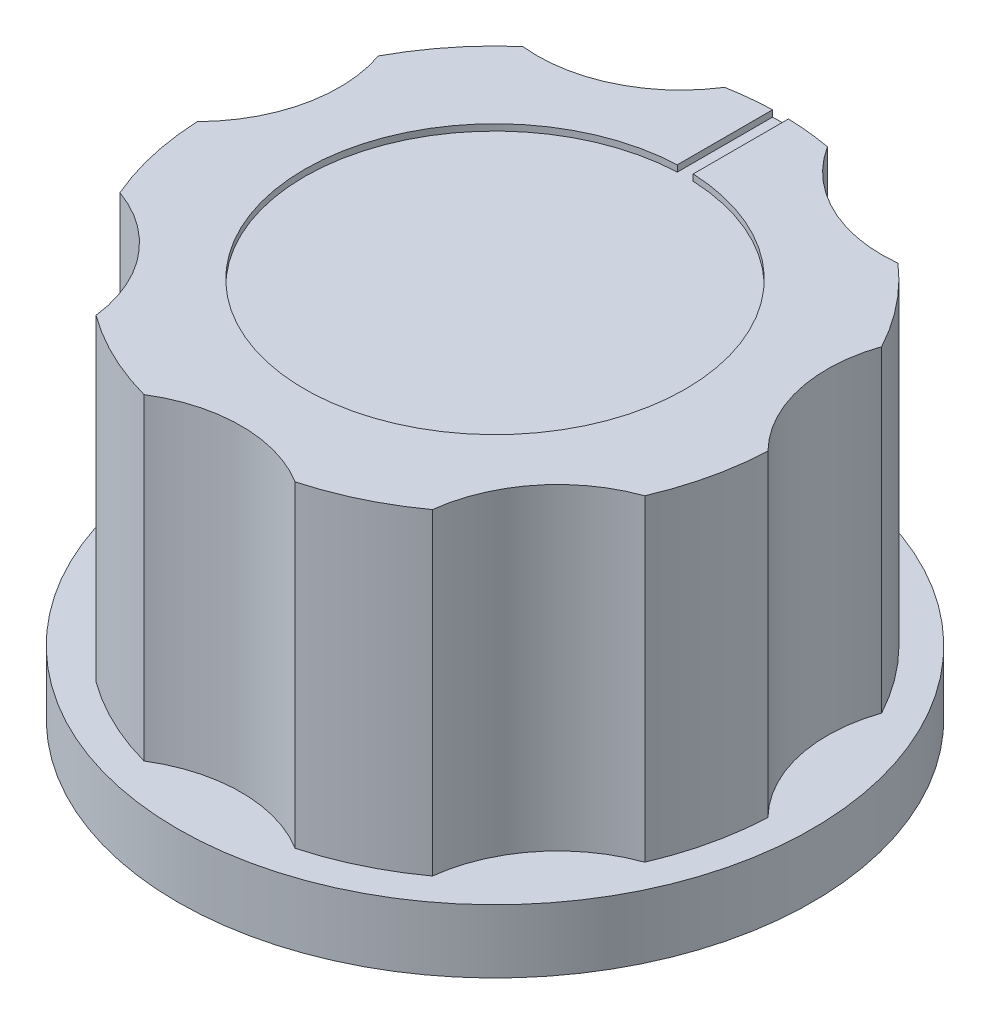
SolidWorks part; units mm, degrees
ref_plane "Alzado" through (0, 0, 0) normal (0, 0, 1) x (1, 0, 0)
ref_plane "Planta" through (0, 0, 0) normal (0, 1, 0) x (1, 0, 0)
ref_plane "Vista lateral" through (0, 0, 0) normal (1, 0, 0) x (0, 0, -1)
sketch "Croquis1" plane through (0, 0, 0) normal (0, 0, 1) x (1, 0, 0)
  line L0 (10, 2) -> (0, 2)
  line L1 (0, 2) -> (0, 0)
  line L2 (0, 0) -> (10, 0)
  line L3 (10, 0) -> (10, 2)
  line L4 (0, 2) -> (0, 0) construction
revolve "Revolución1" add sketch "Croquis1" angle 360 about L4
sketch "Croquis2" plane through (0, 2, 0) normal (0, 1, 0) x (-1, 0, 0)
  arc A0 (-1.6222, -8.8526) -> (-5.9119, -6.786) centre (-5.4313, -11.2739) ccw
  arc A1 (-5.9119, -6.786) -> (-7.9327, -4.2511) centre (0, 0) cw
  arc A2 (-7.9327, -4.2511) -> (-8.9915, 0.39) centre (-12.201, -2.7835) ccw
  arc A3 (-8.9915, 0.39) -> (-8.2699, 3.5508) centre (0, 0) cw
  arc A4 (-8.2699, 3.5508) -> (-5.3016, 7.2728) centre (-9.7838, 7.8028) ccw
  arc A5 (-5.3016, 7.2728) -> (-2.3813, 8.6793) centre (0, 0) cw
  arc A6 (-2.3813, 8.6793) -> (2.3812, 8.6793) centre (0, 12.5135) ccw
  arc A7 (2.3812, 8.6793) -> (5.3005, 7.2735) centre (0, 0) cw
  arc A8 (5.3005, 7.2735) -> (8.2709, 3.5486) centre (9.7831, 7.8013) ccw
  arc A9 (8.2709, 3.5486) -> (8.9915, 0.3905) centre (0, 0) cw
  arc A10 (8.9915, 0.3905) -> (7.9308, -4.2546) centre (12.1986, -2.7855) ccw
  arc A11 (7.9308, -4.2546) -> (5.9106, -6.7871) centre (0, 0) cw
  arc A12 (5.9106, -6.7871) -> (1.6185, -8.8533) centre (5.4275, -11.2747) ccw
  arc A13 (1.6185, -8.8533) -> (-1.6222, -8.8526) centre (0, 0) cw
extrude "Saliente-Extruir1" add sketch "Croquis2" along normal blind 10
sketch "Croquis3" plane through (0, 12, 0) normal (0, 1, 0) x (-1, 0, 0)
  line L0 (0.25, -8.9965) -> (0.25, -5.9948)
  line L1 (-0.25, -5.9948) -> (-0.25, -8.9965)
  arc A0 (0.25, -5.9948) -> (-0.25, -5.9948) centre (0, 0) ccw
  arc A1 (-0.25, -8.9965) -> (0.25, -8.9965) centre (0, 0) ccw
extrude "Cortar-Extruir1" cut sketch "Croquis3" against normal blind 0.2
hole_wizard "Refrentado para perno con cabeza hexagonal de M61" positions "Croquis5" profile "Croquis4" counterbore size "M6" standard "Ansi Metric"
sketch "Croquis5" plane through (0, 0, 0) normal (0, -1, 0) x (-1, 0, 0)
  point P0 (0, 0)
sketch "Croquis4" plane through (0, 0, 0) normal (1, 0, 0) x (0, 0, -1)
  line L0 (0, 0) -> (0, 11)
  line L1 (0, 11) -> (3.5, 11)
  line L2 (3.5, 11) -> (3.5, 2)
  line L3 (3.5, 2) -> (6.5, 2)
  line L4 (6.5, 2) -> (6.5, 0)
  line L5 (6.5, 0) -> (0, 0)
  line L10 (0, 11) -> (-3.5, 11) construction
  line L11 (0, -6.35) -> (0, 107.95) construction
  dimension "Diámetro de taladro" = 7
  dimension "Profundidad de taladro" = 11
  dimension "Diámetro de refrentado" = 13
  dimension "Profundidad de refrentado" = 2
  dimension "Ángulo de perforador" = 180
